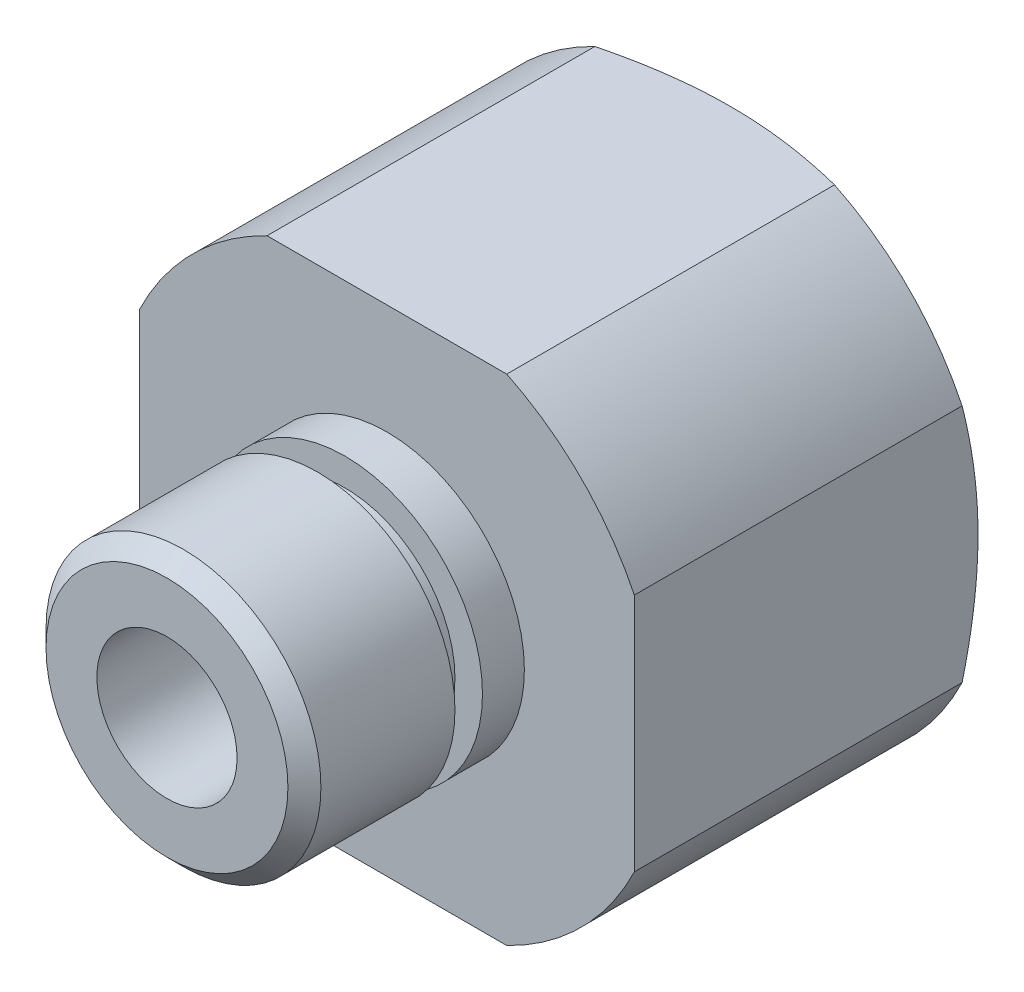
SolidWorks part; units mm, degrees
ref_plane "Plane1" through (0, 0, 0) normal (0, 0, 1) x (1, 0, 0)
ref_plane "Plane2" through (0, 0, 0) normal (0, 1, 0) x (1, 0, 0)
ref_plane "Plane3" through (0, 0, 0) normal (1, 0, 0) x (0, 0, -1)
sketch "Sketch1" plane through (0, 0, 0) normal (0, 0, 1) x (1, 0, 0)
  line L0 (0, 9) -> (0, -9) construction
  line L1 (-4.3589, 9) -> (4.3589, 9)
  line L2 (-9, 4.3589) -> (-9, -4.3589)
  line L3 (-4.3589, -9) -> (4.3589, -9)
  line L4 (9, 4.3589) -> (9, -4.3589)
  line L5 (9, 0) -> (-9, 0) construction
  arc A0 (-9, -4.3589) -> (-4.3589, -9) centre (0, 0) ccw
  arc A1 (-4.3589, 9) -> (-9, 4.3589) centre (0, 0) ccw
  arc A2 (9, 4.3589) -> (4.3589, 9) centre (0, 0) ccw
  arc A3 (4.3589, -9) -> (9, -4.3589) centre (0, 0) ccw
  dimension "C" = 20
  dimension "B" = 18
extrude "Base-Extrude" add sketch "Sketch1" along normal blind 12.5
sketch "Sketch2" plane through (0, 9, 0) normal (0, 1, 0) x (-1, 0, 0)
  line L1 (0, 50) -> (0, -50) construction
  line L2 (-4.3589, 12.5) -> (4.3589, 12.5) construction
  circle A0 centre (0, 4.5) radius 2.5
  dimension "P" = 5
  dimension "GA" = 8
extrude "Port" cut sketch "Sketch2" against normal blind 5
chamfer "Chamfer1" distance 1 angle 30
sketch "Sketch6" plane through (0, 0, 12.5) normal (0, 0, 1) x (1, 0, 0)
  circle A0 centre (0, 0) radius 5
  dimension "D1" = 10
extrude "RodEndThread" add sketch "Sketch6" along normal blind 8
sketch "Sketch5" plane through (0, 0, 0) normal (0, 0, 1) x (1, 0, 0)
  circle A0 centre (0, 0) radius 2.55
  dimension "D1" = 5.1
extrude "ThruBore3" cut sketch "Sketch5" along normal through all
chamfer "Chamfer2" distance 0.6 angle 45
sketch "Sketch7" plane through (0, 0, 14.024) normal (0, 0, 1) x (1, 0, 0)
  circle A0 centre (0, 0) radius 5 construction
  circle A1 centre (0, 0) radius 5
extrude "Cut-Extrude-Thin1" cut sketch "Sketch7" along normal blind 1 thin
